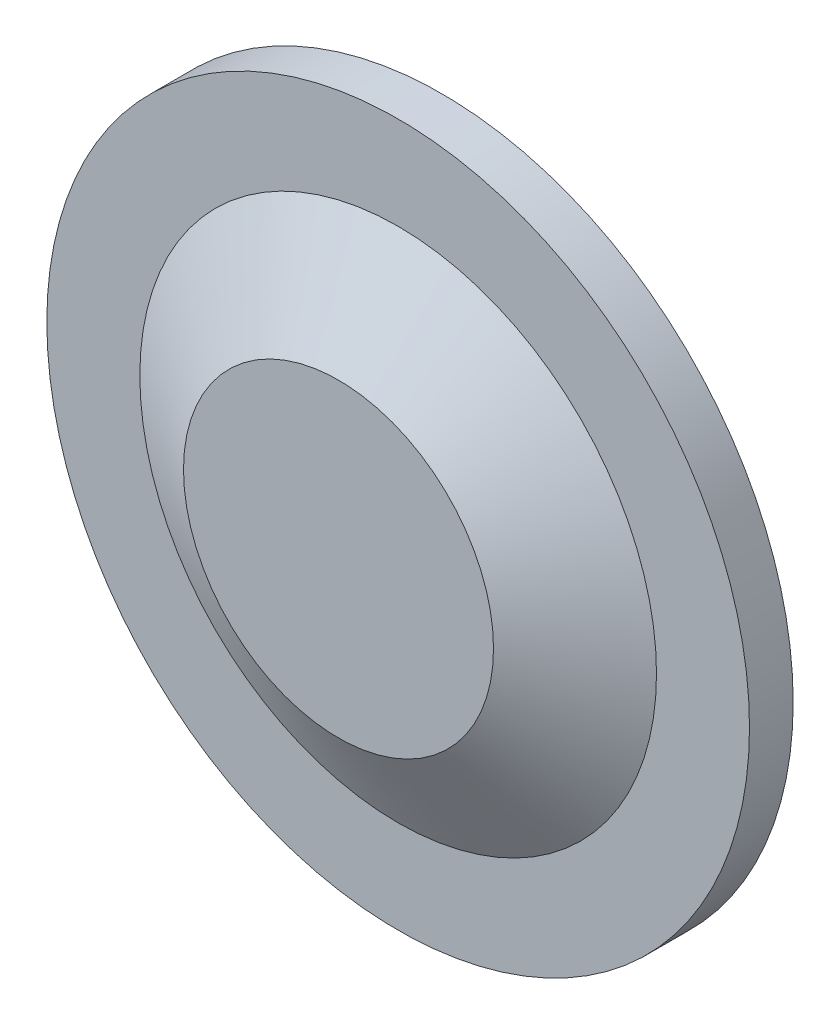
SolidWorks part; units mm, degrees
ref_plane "Front Plane" through (0, 0, 0) normal (0, 0, 1) x (1, 0, 0)
ref_plane "Top Plane" through (0, 0, 0) normal (0, 1, 0) x (1, 0, 0)
ref_plane "Right Plane" through (0, 0, 0) normal (1, 0, 0) x (0, 0, -1)
sketch "Sketch2" plane through (0, 0, 0) normal (0, 1, 0) x (1, 0, 0)
  line L0 (0, 0) -> (0, 423.3157) construction
  line L1 (0, 0) -> (-394.1215, 0) construction
  line L2 (0, 0) -> (850, 0)
  line L3 (850, 0) -> (850, -105.6624)
  line L4 (850, -105.6624) -> (625, -105.6624)
  line L5 (625, -105.6624) -> (375, -250)
  line L6 (375, -250) -> (0, -250)
  line L7 (0, 0) -> (0, -250)
  dimension "D1" = 1700
  dimension "D2" = 250
  dimension "D3" = 1250
  dimension "D4" = 750
  dimension "D5" = 150
revolve "Revolve1" add sketch "Sketch2" angle 360 about L7
